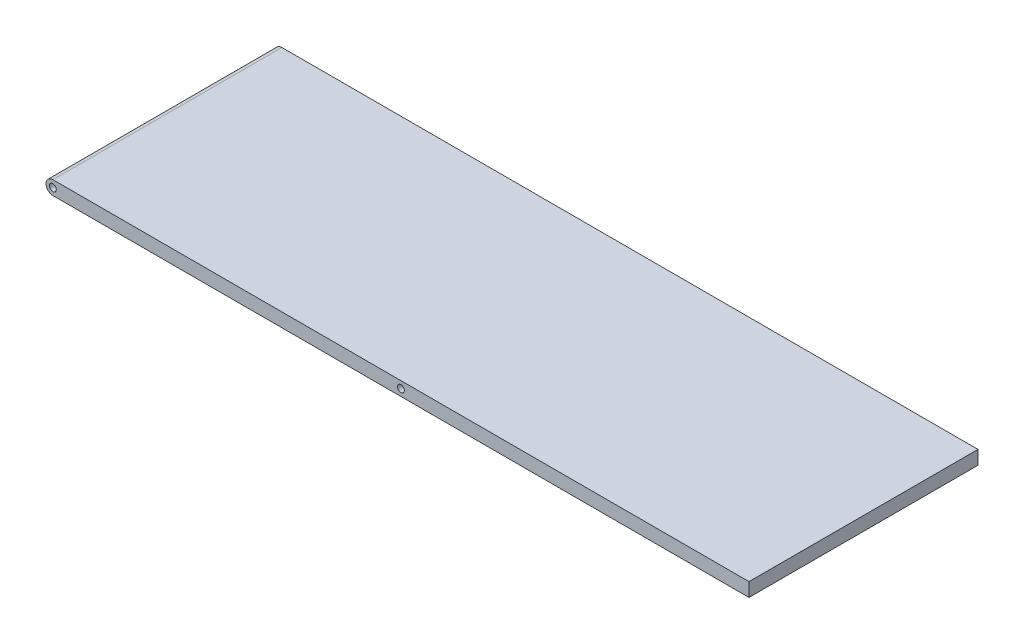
SolidWorks part; units mm, degrees
ref_plane "Plan1" through (0, 0, 0) normal (0, 0, 1) x (1, 0, 0)
ref_plane "Plan2" through (0, 0, 0) normal (0, 1, 0) x (1, 0, 0)
ref_plane "Plan3" through (0, 0, 0) normal (1, 0, 0) x (0, 0, -1)
sketch "Esquisse1" plane through (0, 0, 0) normal (0, 0, 1) x (1, 0, 0)
  line L0 (0, 1.5) -> (152, 1.5)
  line L1 (0, -1.5) -> (152, -1.5)
  line L2 (152, 1.5) -> (152, -1.5)
  arc A0 (0, 1.5) -> (0, -1.5) centre (0, 0) ccw
  dimension "D1" = 3
  dimension "D2" = 152
extrude "Base-Extrusion" add sketch "Esquisse1" along normal blind 50
sketch "Esquisse2" plane through (0, 0, 50) normal (0, 0, 1) x (1, 0, 0)
  line L0 (152, 1.5) -> (0, 1.5) construction
  circle A0 centre (0, 0) radius 0.75
  circle A1 centre (76, 0) radius 0.75
  dimension "D1" = 1.5
  dimension "D2" = 1.5
  dimension "D3" = 76
  dimension "D4" = 1.5
extrude "Enlèv. mat.-Extru.1" cut sketch "Esquisse2" against normal blind 10
